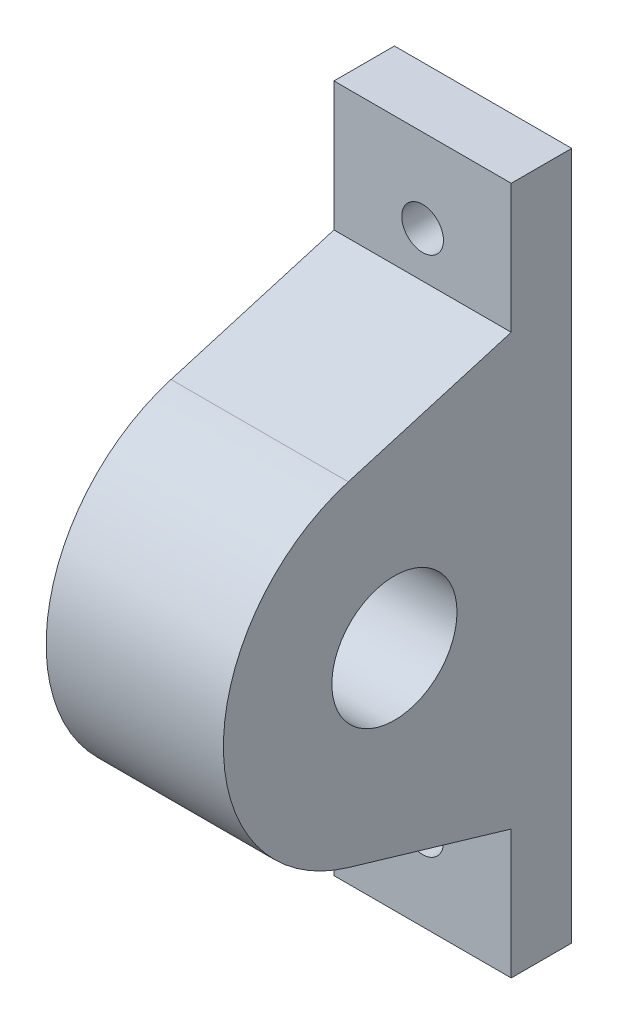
SolidWorks part; units mm, degrees
ref_plane "Front Plane" through (0, 0, 0) normal (1, 0, 0) x (0, 1, 0)
ref_plane "Top Plane" through (0, 0, 0) normal (0, 0, 1) x (0, 1, 0)
ref_plane "Right Plane" through (0, 0, 0) normal (0, 1, 0) x (-1, 0, 0)
sketch "Sketch1" plane through (0, 0, 0) normal (1, 0, 0) x (0, 1, 0)
  line L0 (-165, -83.5) -> (165, -83.5)
  line L1 (165, -83.5) -> (165, -54.5)
  line L2 (165, -54.5) -> (103.1256, -54.5)
  line L3 (80.0905, 23.6171) -> (103.1256, -54.5)
  line L4 (0, 1.5) -> (0, -117.814) construction
  line L5 (-165, -83.5) -> (-165, -54.5)
  line L6 (-80.0905, 23.6171) -> (-103.1256, -54.5)
  line L7 (-165, -54.5) -> (-103.1256, -54.5)
  arc A1 (80.0905, 23.6171) -> (-80.0905, 23.6171) centre (0, 0) ccw
  circle A2 centre (0, 1.5) radius 30
  point P15 (0, -83.5)
  dimension "D1" = 167
  dimension "D2" = 60
  dimension "D3" = 85
  dimension "D4" = 165
  dimension "D5" = 29
extrude "Boss-Extrude1" add sketch "Sketch1" along normal blind 85
sketch "Sketch2" plane through (0, 0, -54.5) normal (0, 0, 1) x (1, 0, 0)
  line L0 (0, 0) -> (42.5, 0) construction
  line L1 (42.5, 0) -> (42.5, 125) construction
  line L2 (85, 165) -> (0, 165) construction
  circle A0 centre (42.5, 125) radius 10
  circle A1 centre (42.5, -125) radius 10
  point P8 (42.5, 165)
  dimension "D2" = 20
  dimension "D1" = 125
extrude "Cut-Extrude1" cut sketch "Sketch2" against normal blind 85
